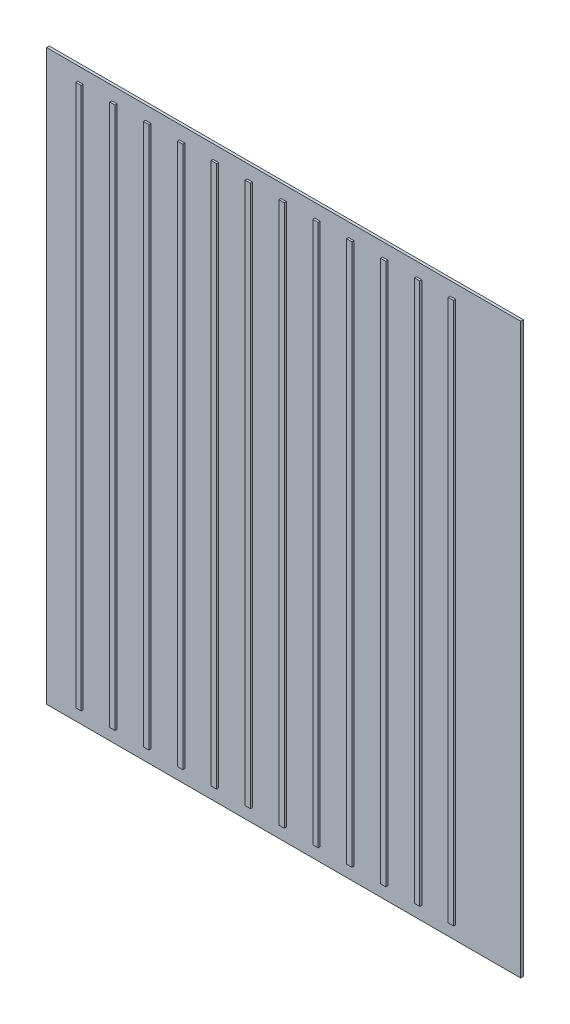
SolidWorks part; units mm, degrees
ref_plane "Front Plane" through (0, 0, 0) normal (0, 0, 1) x (1, 0, 0)
ref_plane "Top Plane" through (0, 0, 0) normal (0, 1, 0) x (1, 0, 0)
ref_plane "Right Plane" through (0, 0, 0) normal (1, 0, 0) x (0, 0, -1)
sketch "Sketch1" plane through (0, 0, 0) normal (0, 0, 1) x (1, 0, 0)
  line L1 (0, 0) -> (3500, 0)
  line L2 (0, 0) -> (0, 4200)
  line L3 (0, 4200) -> (3500, 4200)
  line L4 (3500, 0) -> (3500, 4200)
extrude "Boss-Extrude1" add sketch "Sketch1" along normal blind 20
sketch "Sketch2" plane through (0, 0, 0) normal (0, 0, 1) x (1, 0, 0)
  line L1 (230, 100) -> (270, 100)
  line L2 (230, 100) -> (230, 4100)
  line L3 (230, 4100) -> (270, 4100)
  line L4 (270, 100) -> (270, 4100)
  line L5 (480, 100) -> (520, 100)
  line L6 (480, 100) -> (480, 4100)
  line L7 (480, 4100) -> (520, 4100)
  line L8 (520, 100) -> (520, 4100)
  line L9 (730, 100) -> (770, 100)
  line L10 (730, 100) -> (730, 4100)
  line L11 (730, 4100) -> (770, 4100)
  line L12 (770, 100) -> (770, 4100)
  line L13 (980, 100) -> (1020, 100)
  line L14 (980, 100) -> (980, 4100)
  line L15 (980, 4100) -> (1020, 4100)
  line L16 (1020, 100) -> (1020, 4100)
  line L17 (1230, 100) -> (1270, 100)
  line L18 (1230, 100) -> (1230, 4100)
  line L19 (1230, 4100) -> (1270, 4100)
  line L20 (1270, 100) -> (1270, 4100)
  line L21 (1480, 100) -> (1520, 100)
  line L22 (1480, 100) -> (1480, 4100)
  line L23 (1480, 4100) -> (1520, 4100)
  line L24 (1520, 100) -> (1520, 4100)
  line L25 (1730, 100) -> (1770, 100)
  line L26 (1730, 100) -> (1730, 4100)
  line L27 (1730, 4100) -> (1770, 4100)
  line L28 (1770, 100) -> (1770, 4100)
  line L29 (1980, 100) -> (2020, 100)
  line L30 (1980, 100) -> (1980, 4100)
  line L31 (1980, 4100) -> (2020, 4100)
  line L32 (2020, 100) -> (2020, 4100)
  line L33 (2230, 100) -> (2270, 100)
  line L34 (2230, 100) -> (2230, 4100)
  line L35 (2230, 4100) -> (2270, 4100)
  line L36 (2270, 100) -> (2270, 4100)
  line L37 (2480, 100) -> (2520, 100)
  line L38 (2480, 100) -> (2480, 4100)
  line L39 (2480, 4100) -> (2520, 4100)
  line L40 (2520, 100) -> (2520, 4100)
  line L41 (2730, 100) -> (2770, 100)
  line L42 (2730, 100) -> (2730, 4100)
  line L43 (2730, 4100) -> (2770, 4100)
  line L44 (2770, 100) -> (2770, 4100)
  line L45 (2980, 100) -> (3020, 100)
  line L46 (2980, 100) -> (2980, 4100)
  line L47 (2980, 4100) -> (3020, 4100)
  line L48 (3020, 100) -> (3020, 4100)
extrude "Boss-Extrude2" add sketch "Sketch2" along normal blind 35
